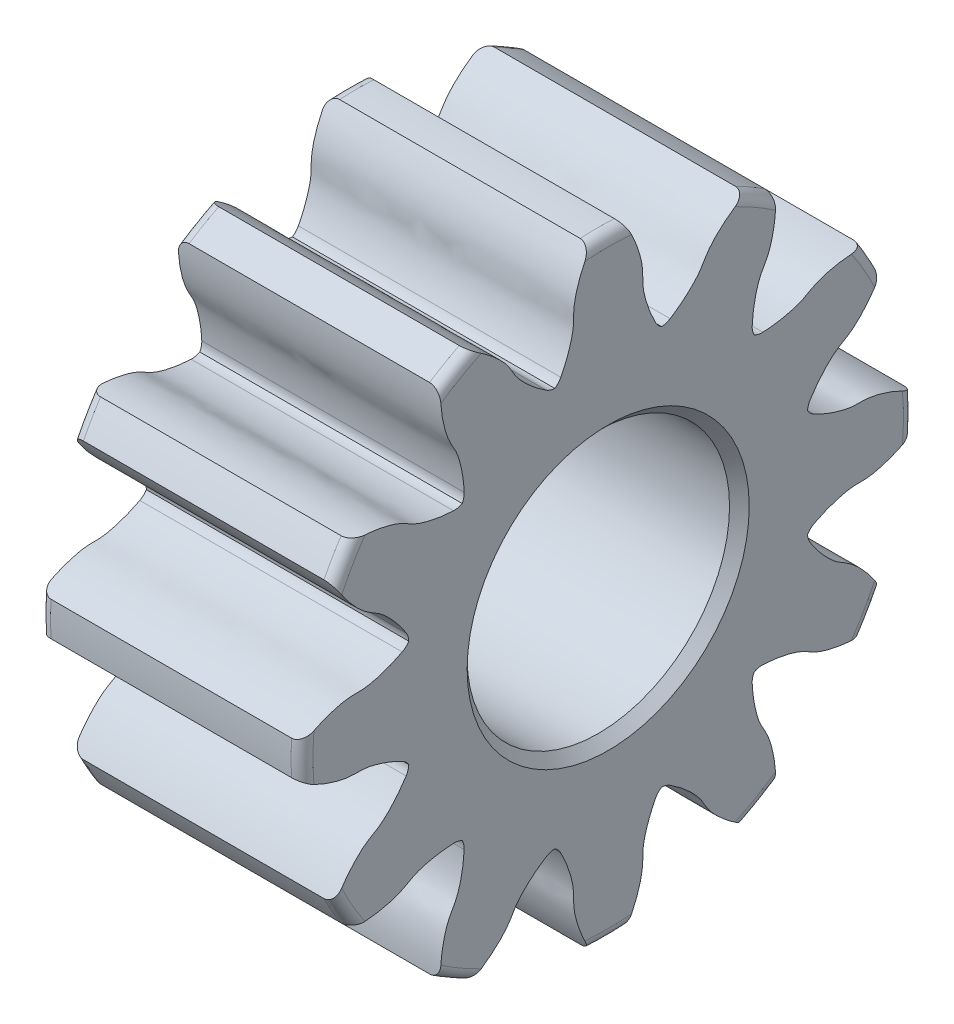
SolidWorks part; units mm, degrees
ref_plane "Front Plane" through (0, 0, 0) normal (0, 0, 1) x (1, 0, 0)
ref_plane "Top Plane" through (0, 0, 0) normal (0, 1, 0) x (1, 0, 0)
ref_plane "Right Plane" through (0, 0, 0) normal (1, 0, 0) x (0, 0, -1)
ref_plane "Plane1" through (1.5875, 0, 0) normal (1, 0, 0) x (0, 0, -1)
sketch "Sketch1" plane through (1.5875, 0, 0) normal (1, 0, 0) x (0, 0, -1)
  arc A0 (0.2073, 3.6984) -> (-0.2073, 3.6984) centre (0, 0) ccw
  arc A1 (-0.5733, 2.492) -> (-0.6465, 2.4126) centre (-0.7564, 2.5873) cw
  arc A2 (-0.6465, 2.4126) -> (-0.7495, 2.4448) centre (-0.6386, 2.6188) cw
  arc A3 (-1.6696, 3.3065) -> (-2.0287, 3.0992) centre (0, 0) ccw
  arc A4 (-1.7425, 1.8715) -> (-1.7662, 1.7662) centre (-1.9487, 1.8624) cw
  arc A5 (-1.7662, 1.7662) -> (-1.8715, 1.7425) centre (-1.8624, 1.9487) cw
  arc A6 (-3.0992, 2.0287) -> (-3.3065, 1.6696) centre (0, 0) ccw
  arc A7 (-2.4448, 0.7495) -> (-2.4126, 0.6465) centre (-2.6188, 0.6386) cw
  arc A8 (-2.4126, 0.6465) -> (-2.492, 0.5733) centre (-2.5873, 0.7564) cw
  arc A9 (-3.6984, 0.2073) -> (-3.6984, -0.2073) centre (0, 0) ccw
  arc A10 (-2.492, -0.5733) -> (-2.4126, -0.6465) centre (-2.5873, -0.7564) cw
  arc A11 (-2.4126, -0.6465) -> (-2.4448, -0.7495) centre (-2.6188, -0.6386) cw
  arc A12 (-3.3065, -1.6696) -> (-3.0992, -2.0287) centre (0, 0) ccw
  arc A13 (-1.8715, -1.7425) -> (-1.7662, -1.7662) centre (-1.8624, -1.9487) cw
  arc A14 (-1.7662, -1.7662) -> (-1.7425, -1.8715) centre (-1.9487, -1.8624) cw
  arc A15 (-2.0287, -3.0992) -> (-1.6696, -3.3065) centre (0, 0) ccw
  arc A16 (-0.7495, -2.4448) -> (-0.6465, -2.4126) centre (-0.6386, -2.6188) cw
  arc A17 (-0.6465, -2.4126) -> (-0.5733, -2.492) centre (-0.7564, -2.5873) cw
  arc A18 (-0.2073, -3.6984) -> (0.2073, -3.6984) centre (0, 0) ccw
  arc A19 (0.5733, -2.492) -> (0.6465, -2.4126) centre (0.7564, -2.5873) cw
  arc A20 (0.6465, -2.4126) -> (0.7495, -2.4448) centre (0.6386, -2.6188) cw
  arc A21 (1.6696, -3.3065) -> (2.0287, -3.0992) centre (0, 0) ccw
  arc A22 (1.7425, -1.8715) -> (1.7662, -1.7662) centre (1.9487, -1.8624) cw
  arc A23 (1.7662, -1.7662) -> (1.8715, -1.7425) centre (1.8624, -1.9487) cw
  arc A24 (3.0992, -2.0287) -> (3.3065, -1.6696) centre (0, 0) ccw
  arc A25 (2.4448, -0.7495) -> (2.4126, -0.6465) centre (2.6188, -0.6386) cw
  arc A26 (2.4126, -0.6465) -> (2.492, -0.5733) centre (2.5873, -0.7564) cw
  arc A27 (3.6984, -0.2073) -> (3.6984, 0.2073) centre (0, 0) ccw
  arc A28 (2.492, 0.5733) -> (2.4126, 0.6465) centre (2.5873, 0.7564) cw
  arc A29 (2.4126, 0.6465) -> (2.4448, 0.7495) centre (2.6188, 0.6386) cw
  arc A30 (3.3065, 1.6696) -> (3.0992, 2.0287) centre (0, 0) ccw
  arc A31 (1.8715, 1.7425) -> (1.7662, 1.7662) centre (1.8624, 1.9487) cw
  arc A32 (1.7662, 1.7662) -> (1.7425, 1.8715) centre (1.9487, 1.8624) cw
  arc A33 (2.0287, 3.0992) -> (1.6696, 3.3065) centre (0, 0) ccw
  arc A34 (0.7495, 2.4448) -> (0.6465, 2.4126) centre (0.6386, 2.6188) cw
  arc A35 (0.6465, 2.4126) -> (0.5733, 2.492) centre (0.7564, 2.5873) cw
  spline S0 degree 3 poles (0.2073, 3.6984) (0.2339, 3.6535) (0.259, 3.6076) (0.2821, 3.5607) (0.3357, 3.4517) (0.3775, 3.3357) (0.4032, 3.2169) (0.4161, 3.1575) (0.4195, 3.0958) (0.4178, 3.035) (0.4157, 2.9554) (0.4305, 2.8754) (0.4515, 2.7987) (0.4805, 2.6926) (0.5226, 2.5896) (0.5733, 2.492) knots -0.000156 -0.000156 -0.000156 -0.000156 0 0 0 0.000364 0.000364 0.000364 0.000547 0.000547 0.000547 0.000788 0.000788 0.000788 0.001121 0.001121 0.001121 0.001121
  spline S1 degree 3 poles (-0.5733, 2.492) (-0.5145, 2.605) (-0.4679, 2.7257) (-0.4385, 2.8497) (-0.4238, 2.9117) (-0.4161, 2.9761) (-0.418, 3.0399) (-0.4204, 3.1245) (-0.4071, 3.2099) (-0.3848, 3.2916) (-0.3596, 3.3842) (-0.3244, 3.4745) (-0.2821, 3.5607) (-0.259, 3.6076) (-0.2339, 3.6535) (-0.2073, 3.6984) knots 0 0 0 0 0.000382 0.000382 0.000382 0.000574 0.000574 0.000574 0.000828 0.000828 0.000828 0.001116 0.001116 0.001116 0.001272 0.001272 0.001272 0.001272
  spline S2 degree 3 poles (-1.6696, 3.3065) (-1.6241, 3.281) (-1.5795, 3.2538) (-1.5361, 3.2247) (-1.4351, 3.1571) (-1.3409, 3.0775) (-1.2593, 2.9876) (-1.2184, 2.9425) (-1.1846, 2.8908) (-1.1556, 2.8373) (-1.1177, 2.7673) (-1.0649, 2.7055) (-1.0083, 2.6495) (-0.9302, 2.5721) (-0.8422, 2.5039) (-0.7495, 2.4448) knots -0.000156 -0.000156 -0.000156 -0.000156 0 0 0 0.000364 0.000364 0.000364 0.000547 0.000547 0.000547 0.000788 0.000788 0.000788 0.001121 0.001121 0.001121 0.001121
  spline S3 degree 3 poles (-1.7425, 1.8715) (-1.7481, 1.9988) (-1.7681, 2.1266) (-1.8046, 2.2487) (-1.8229, 2.3098) (-1.8485, 2.3693) (-1.8819, 2.4236) (-1.9263, 2.4957) (-1.9575, 2.5763) (-1.9791, 2.6582) (-2.0035, 2.751) (-2.0182, 2.8468) (-2.0246, 2.9426) (-2.0281, 2.9947) (-2.0293, 3.047) (-2.0287, 3.0992) knots 0 0 0 0 0.000382 0.000382 0.000382 0.000574 0.000574 0.000574 0.000828 0.000828 0.000828 0.001116 0.001116 0.001116 0.001272 0.001272 0.001272 0.001272
  spline S4 degree 3 poles (-3.0992, 2.0287) (-3.047, 2.0293) (-2.9947, 2.0281) (-2.9426, 2.0246) (-2.8214, 2.0165) (-2.7001, 1.9947) (-2.5844, 1.9576) (-2.5264, 1.9391) (-2.4713, 1.9112) (-2.4194, 1.8793) (-2.3516, 1.8377) (-2.2749, 1.8106) (-2.198, 1.7903) (-2.0916, 1.7624) (-1.9814, 1.7473) (-1.8715, 1.7425) knots -0.000156 -0.000156 -0.000156 -0.000156 0 0 0 0.000364 0.000364 0.000364 0.000547 0.000547 0.000547 0.000788 0.000788 0.000788 0.001121 0.001121 0.001121 0.001121
  spline S5 degree 3 poles (-2.4448, 0.7495) (-2.5133, 0.8569) (-2.5945, 0.9576) (-2.6872, 1.0451) (-2.7335, 1.0889) (-2.7855, 1.1277) (-2.8416, 1.158) (-2.916, 1.1982) (-2.9834, 1.2524) (-3.043, 1.3125) (-3.1106, 1.3807) (-3.1713, 1.4563) (-3.2247, 1.5361) (-3.2538, 1.5795) (-3.281, 1.6241) (-3.3065, 1.6696) knots 0 0 0 0 0.000382 0.000382 0.000382 0.000574 0.000574 0.000574 0.000828 0.000828 0.000828 0.001116 0.001116 0.001116 0.001272 0.001272 0.001272 0.001272
  spline S6 degree 3 poles (-3.6984, 0.2073) (-3.6535, 0.2339) (-3.6076, 0.259) (-3.5607, 0.2821) (-3.4517, 0.3357) (-3.3357, 0.3775) (-3.2169, 0.4032) (-3.1575, 0.4161) (-3.0958, 0.4195) (-3.035, 0.4178) (-2.9554, 0.4157) (-2.8754, 0.4305) (-2.7987, 0.4515) (-2.6926, 0.4805) (-2.5896, 0.5226) (-2.492, 0.5733) knots -0.000156 -0.000156 -0.000156 -0.000156 0 0 0 0.000364 0.000364 0.000364 0.000547 0.000547 0.000547 0.000788 0.000788 0.000788 0.001121 0.001121 0.001121 0.001121
  spline S7 degree 3 poles (-2.492, -0.5733) (-2.605, -0.5145) (-2.7257, -0.4679) (-2.8497, -0.4385) (-2.9117, -0.4238) (-2.9761, -0.4161) (-3.0399, -0.418) (-3.1245, -0.4204) (-3.2099, -0.4071) (-3.2916, -0.3848) (-3.3842, -0.3596) (-3.4745, -0.3244) (-3.5607, -0.2821) (-3.6076, -0.259) (-3.6535, -0.2339) (-3.6984, -0.2073) knots 0 0 0 0 0.000382 0.000382 0.000382 0.000574 0.000574 0.000574 0.000828 0.000828 0.000828 0.001116 0.001116 0.001116 0.001272 0.001272 0.001272 0.001272
  spline S8 degree 3 poles (-3.3065, -1.6696) (-3.281, -1.6241) (-3.2538, -1.5795) (-3.2247, -1.5361) (-3.1571, -1.4351) (-3.0775, -1.3409) (-2.9876, -1.2593) (-2.9425, -1.2184) (-2.8908, -1.1846) (-2.8373, -1.1556) (-2.7673, -1.1177) (-2.7055, -1.0649) (-2.6495, -1.0083) (-2.5721, -0.9302) (-2.5039, -0.8422) (-2.4448, -0.7495) knots -0.000156 -0.000156 -0.000156 -0.000156 0 0 0 0.000364 0.000364 0.000364 0.000547 0.000547 0.000547 0.000788 0.000788 0.000788 0.001121 0.001121 0.001121 0.001121
  spline S9 degree 3 poles (-1.8715, -1.7425) (-1.9988, -1.7481) (-2.1266, -1.7681) (-2.2487, -1.8046) (-2.3098, -1.8229) (-2.3693, -1.8485) (-2.4236, -1.8819) (-2.4957, -1.9263) (-2.5763, -1.9575) (-2.6582, -1.9791) (-2.751, -2.0035) (-2.8468, -2.0182) (-2.9426, -2.0246) (-2.9947, -2.0281) (-3.047, -2.0293) (-3.0992, -2.0287) knots 0 0 0 0 0.000382 0.000382 0.000382 0.000574 0.000574 0.000574 0.000828 0.000828 0.000828 0.001116 0.001116 0.001116 0.001272 0.001272 0.001272 0.001272
  spline S10 degree 3 poles (-2.0287, -3.0992) (-2.0293, -3.047) (-2.0281, -2.9947) (-2.0246, -2.9426) (-2.0165, -2.8214) (-1.9947, -2.7001) (-1.9576, -2.5844) (-1.9391, -2.5264) (-1.9112, -2.4713) (-1.8793, -2.4194) (-1.8377, -2.3516) (-1.8106, -2.2749) (-1.7903, -2.198) (-1.7624, -2.0916) (-1.7473, -1.9814) (-1.7425, -1.8715) knots -0.000156 -0.000156 -0.000156 -0.000156 0 0 0 0.000364 0.000364 0.000364 0.000547 0.000547 0.000547 0.000788 0.000788 0.000788 0.001121 0.001121 0.001121 0.001121
  spline S11 degree 3 poles (-0.7495, -2.4448) (-0.8569, -2.5133) (-0.9576, -2.5945) (-1.0451, -2.6872) (-1.0889, -2.7335) (-1.1277, -2.7855) (-1.158, -2.8416) (-1.1982, -2.916) (-1.2524, -2.9834) (-1.3125, -3.043) (-1.3807, -3.1106) (-1.4563, -3.1713) (-1.5361, -3.2247) (-1.5795, -3.2538) (-1.6241, -3.281) (-1.6696, -3.3065) knots 0 0 0 0 0.000382 0.000382 0.000382 0.000574 0.000574 0.000574 0.000828 0.000828 0.000828 0.001116 0.001116 0.001116 0.001272 0.001272 0.001272 0.001272
  spline S12 degree 3 poles (-0.2073, -3.6984) (-0.2339, -3.6535) (-0.259, -3.6076) (-0.2821, -3.5607) (-0.3357, -3.4517) (-0.3775, -3.3357) (-0.4032, -3.2169) (-0.4161, -3.1575) (-0.4195, -3.0958) (-0.4178, -3.035) (-0.4157, -2.9554) (-0.4305, -2.8754) (-0.4515, -2.7987) (-0.4805, -2.6926) (-0.5226, -2.5896) (-0.5733, -2.492) knots -0.000156 -0.000156 -0.000156 -0.000156 0 0 0 0.000364 0.000364 0.000364 0.000547 0.000547 0.000547 0.000788 0.000788 0.000788 0.001121 0.001121 0.001121 0.001121
  spline S13 degree 3 poles (0.5733, -2.492) (0.5145, -2.605) (0.4679, -2.7257) (0.4385, -2.8497) (0.4238, -2.9117) (0.4161, -2.9761) (0.418, -3.0399) (0.4204, -3.1245) (0.4071, -3.2099) (0.3848, -3.2916) (0.3596, -3.3842) (0.3244, -3.4745) (0.2821, -3.5607) (0.259, -3.6076) (0.2339, -3.6535) (0.2073, -3.6984) knots 0 0 0 0 0.000382 0.000382 0.000382 0.000574 0.000574 0.000574 0.000828 0.000828 0.000828 0.001116 0.001116 0.001116 0.001272 0.001272 0.001272 0.001272
  spline S14 degree 3 poles (1.6696, -3.3065) (1.6241, -3.281) (1.5795, -3.2538) (1.5361, -3.2247) (1.4351, -3.1571) (1.3409, -3.0775) (1.2593, -2.9876) (1.2184, -2.9425) (1.1846, -2.8908) (1.1556, -2.8373) (1.1177, -2.7673) (1.0649, -2.7055) (1.0083, -2.6495) (0.9302, -2.5721) (0.8422, -2.5039) (0.7495, -2.4448) knots -0.000156 -0.000156 -0.000156 -0.000156 0 0 0 0.000364 0.000364 0.000364 0.000547 0.000547 0.000547 0.000788 0.000788 0.000788 0.001121 0.001121 0.001121 0.001121
  spline S15 degree 3 poles (1.7425, -1.8715) (1.7481, -1.9988) (1.7681, -2.1266) (1.8046, -2.2487) (1.8229, -2.3098) (1.8485, -2.3693) (1.8819, -2.4236) (1.9263, -2.4957) (1.9575, -2.5763) (1.9791, -2.6582) (2.0035, -2.751) (2.0182, -2.8468) (2.0246, -2.9426) (2.0281, -2.9947) (2.0293, -3.047) (2.0287, -3.0992) knots 0 0 0 0 0.000382 0.000382 0.000382 0.000574 0.000574 0.000574 0.000828 0.000828 0.000828 0.001116 0.001116 0.001116 0.001272 0.001272 0.001272 0.001272
  spline S16 degree 3 poles (3.0992, -2.0287) (3.047, -2.0293) (2.9947, -2.0281) (2.9426, -2.0246) (2.8214, -2.0165) (2.7001, -1.9947) (2.5844, -1.9576) (2.5264, -1.9391) (2.4713, -1.9112) (2.4194, -1.8793) (2.3516, -1.8377) (2.2749, -1.8106) (2.198, -1.7903) (2.0916, -1.7624) (1.9814, -1.7473) (1.8715, -1.7425) knots -0.000156 -0.000156 -0.000156 -0.000156 0 0 0 0.000364 0.000364 0.000364 0.000547 0.000547 0.000547 0.000788 0.000788 0.000788 0.001121 0.001121 0.001121 0.001121
  spline S17 degree 3 poles (2.4448, -0.7495) (2.5133, -0.8569) (2.5945, -0.9576) (2.6872, -1.0451) (2.7335, -1.0889) (2.7855, -1.1277) (2.8416, -1.158) (2.916, -1.1982) (2.9834, -1.2524) (3.043, -1.3125) (3.1106, -1.3807) (3.1713, -1.4563) (3.2247, -1.5361) (3.2538, -1.5795) (3.281, -1.6241) (3.3065, -1.6696) knots 0 0 0 0 0.000382 0.000382 0.000382 0.000574 0.000574 0.000574 0.000828 0.000828 0.000828 0.001116 0.001116 0.001116 0.001272 0.001272 0.001272 0.001272
  spline S18 degree 3 poles (3.6984, -0.2073) (3.6535, -0.2339) (3.6076, -0.259) (3.5607, -0.2821) (3.4517, -0.3357) (3.3357, -0.3775) (3.2169, -0.4032) (3.1575, -0.4161) (3.0958, -0.4195) (3.035, -0.4178) (2.9554, -0.4157) (2.8754, -0.4305) (2.7987, -0.4515) (2.6926, -0.4805) (2.5896, -0.5226) (2.492, -0.5733) knots -0.000156 -0.000156 -0.000156 -0.000156 0 0 0 0.000364 0.000364 0.000364 0.000547 0.000547 0.000547 0.000788 0.000788 0.000788 0.001121 0.001121 0.001121 0.001121
  spline S19 degree 3 poles (2.492, 0.5733) (2.605, 0.5145) (2.7257, 0.4679) (2.8497, 0.4385) (2.9117, 0.4238) (2.9761, 0.4161) (3.0399, 0.418) (3.1245, 0.4204) (3.2099, 0.4071) (3.2916, 0.3848) (3.3842, 0.3596) (3.4745, 0.3244) (3.5607, 0.2821) (3.6076, 0.259) (3.6535, 0.2339) (3.6984, 0.2073) knots 0 0 0 0 0.000382 0.000382 0.000382 0.000574 0.000574 0.000574 0.000828 0.000828 0.000828 0.001116 0.001116 0.001116 0.001272 0.001272 0.001272 0.001272
  spline S20 degree 3 poles (3.3065, 1.6696) (3.281, 1.6241) (3.2538, 1.5795) (3.2247, 1.5361) (3.1571, 1.4351) (3.0775, 1.3409) (2.9876, 1.2593) (2.9425, 1.2184) (2.8908, 1.1846) (2.8373, 1.1556) (2.7673, 1.1177) (2.7055, 1.0649) (2.6495, 1.0083) (2.5721, 0.9302) (2.5039, 0.8422) (2.4448, 0.7495) knots -0.000156 -0.000156 -0.000156 -0.000156 0 0 0 0.000364 0.000364 0.000364 0.000547 0.000547 0.000547 0.000788 0.000788 0.000788 0.001121 0.001121 0.001121 0.001121
  spline S21 degree 3 poles (1.8715, 1.7425) (1.9988, 1.7481) (2.1266, 1.7681) (2.2487, 1.8046) (2.3098, 1.8229) (2.3693, 1.8485) (2.4236, 1.8819) (2.4957, 1.9263) (2.5763, 1.9575) (2.6582, 1.9791) (2.751, 2.0035) (2.8468, 2.0182) (2.9426, 2.0246) (2.9947, 2.0281) (3.047, 2.0293) (3.0992, 2.0287) knots 0 0 0 0 0.000382 0.000382 0.000382 0.000574 0.000574 0.000574 0.000828 0.000828 0.000828 0.001116 0.001116 0.001116 0.001272 0.001272 0.001272 0.001272
  spline S22 degree 3 poles (2.0287, 3.0992) (2.0293, 3.047) (2.0281, 2.9947) (2.0246, 2.9426) (2.0165, 2.8214) (1.9947, 2.7001) (1.9576, 2.5844) (1.9391, 2.5264) (1.9112, 2.4713) (1.8793, 2.4194) (1.8377, 2.3516) (1.8106, 2.2749) (1.7903, 2.198) (1.7624, 2.0916) (1.7473, 1.9814) (1.7425, 1.8715) knots -0.000156 -0.000156 -0.000156 -0.000156 0 0 0 0.000364 0.000364 0.000364 0.000547 0.000547 0.000547 0.000788 0.000788 0.000788 0.001121 0.001121 0.001121 0.001121
  spline S23 degree 3 poles (0.7495, 2.4448) (0.8569, 2.5133) (0.9576, 2.5945) (1.0451, 2.6872) (1.0889, 2.7335) (1.1277, 2.7855) (1.158, 2.8416) (1.1982, 2.916) (1.2524, 2.9834) (1.3125, 3.043) (1.3807, 3.1106) (1.4563, 3.1713) (1.5361, 3.2247) (1.5795, 3.2538) (1.6241, 3.281) (1.6696, 3.3065) knots 0 0 0 0 0.000382 0.000382 0.000382 0.000574 0.000574 0.000574 0.000828 0.000828 0.000828 0.001116 0.001116 0.001116 0.001272 0.001272 0.001272 0.001272
extrude "Boss-Extrude1" add sketch "Sketch1" against normal blind 3.175
hole_wizard "Hole1" positions "Sketch3" profile "Sketch2" legacy
sketch "Sketch3" plane through (1.5875, 0, 0) normal (1, 0, 0) x (0, 0, -1)
  point P0 (0, 0)
sketch "Sketch2" plane through (1.5875, 0, 0) normal (0, 1, 0) x (0, 0, -1)
  line L0 (0, 0) -> (0, 3.175)
  line L1 (0, 3.175) -> (1.5875, 3.175)
  line L2 (1.5875, 3.175) -> (1.5875, 0)
  line L3 (1.5875, 0) -> (0, 0)
  line L4 (0, 110) -> (0, -10) construction
  dimension "Diameter" = 3.175
  dimension "Depth" = 3.175
chamfer "Chamfer1" distance 0.1191 angle 45 1 edges at (1.5875, 0, -1.5875)
chamfer "Chamfer2" distance 0.1191 angle 45 1 edges at (-1.5875, 0, -1.5875)
fillet "Fillet1" radius 0.1323 1 edges at (1.5875, 3.2079, 1.8521)
fillet "Fillet2" radius 0.1323 1 edges at (1.5875, 1.8521, 3.2079)
fillet "Fillet3" radius 0.1323 1 edges at (-1.5875, 1.8521, -3.2079)
fillet "Fillet4" radius 0.1323 1 edges at (-1.5875, -1.8521, -3.2079)
fillet "Fillet5" radius 0.1323 1 edges at (-1.5875, -3.7042, 0)
fillet "Fillet6" radius 0.1323 1 edges at (-1.5875, -1.8521, 3.2079)
fillet "Fillet7" radius 0.1323 1 edges at (-1.5875, 1.8521, 3.2079)
fillet "Fillet8" radius 0.1323 1 edges at (-1.5875, 3.7042, 0)
fillet "Fillet9" radius 0.1323 1 edges at (1.5875, 3.7042, 0)
fillet "Fillet10" radius 0.1323 1 edges at (1.5875, 3.2079, -1.8521)
fillet "Fillet11" radius 0.1323 1 edges at (1.5875, 0, -3.7042)
fillet "Fillet12" radius 0.1323 1 edges at (1.5875, -3.2079, -1.8521)
fillet "Fillet13" radius 0.1323 1 edges at (1.5875, -3.2079, 1.8521)
fillet "Fillet14" radius 0.1323 1 edges at (1.5875, 0, 3.7042)
fillet "Fillet15" radius 0.1323 1 edges at (-1.5875, 0, -3.7042)
fillet "Fillet16" radius 0.1323 1 edges at (-1.5875, -3.2079, 1.8521)
fillet "Fillet17" radius 0.1323 1 edges at (-1.5875, 3.2079, 1.8521)
fillet "Fillet18" radius 0.1323 1 edges at (1.5875, -1.8521, -3.2079)
fillet "Fillet19" radius 0.1323 1 edges at (1.5875, -1.8521, 3.2079)
fillet "Fillet20" radius 0.1323 1 edges at (-1.5875, -3.2079, -1.8521)
fillet "Fillet21" radius 0.1323 1 edges at (1.5875, -3.7042, 0)
fillet "Fillet22" radius 0.1323 1 edges at (-1.5875, 0, 3.7042)
fillet "Fillet23" radius 0.1323 1 edges at (-1.5875, 3.2079, -1.8521)
fillet "Fillet24" radius 0.1323 1 edges at (1.5875, 1.8521, -3.2079)
